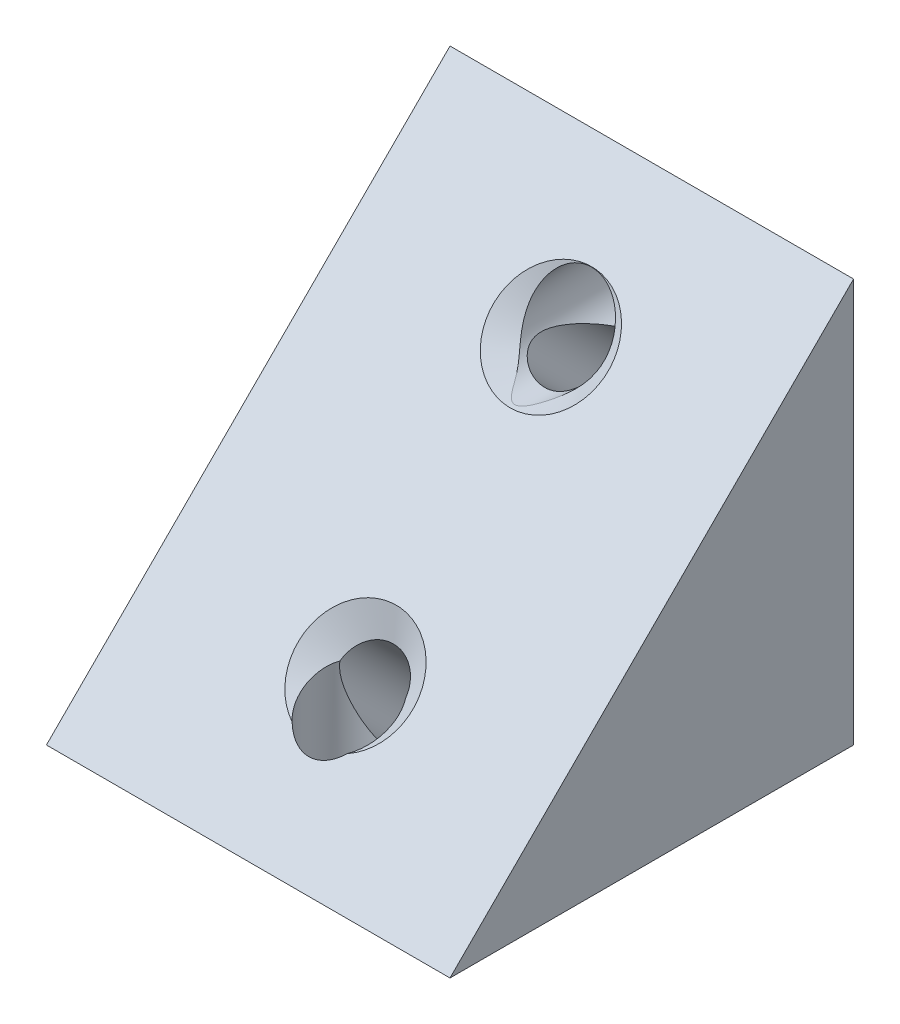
SolidWorks part; units mm, degrees
ref_plane "Спереди" through (0, 0, 0) normal (0, 0, 1) x (1, 0, 0)
ref_plane "Сверху" through (0, 0, 0) normal (0, 1, 0) x (1, 0, 0)
ref_plane "Справа" through (0, 0, 0) normal (1, 0, 0) x (0, 0, -1)
sketch "Эскиз1" plane through (0, 0, 0) normal (0, 0, 1) x (1, 0, 0)
  line L1 (-33.7187, 20) -> (-13.7187, 20)
  line L2 (-33.7187, 20) -> (-33.7187, 0)
  line L3 (-33.7187, 0) -> (-13.7187, 0)
  line L4 (-13.7187, 20) -> (-13.7187, 0)
extrude "Бобышка-Вытянуть1" add sketch "Эскиз1" along normal blind 20
chamfer "Фаска3" distance 20 angle 45 1 edges at (-23.7187, 20, 20)
sketch "Эскиз2" plane through (0, 0, 0) normal (0, -1, 0) x (1, 0, 0)
  line L0 (-13.7187, 20) -> (-13.7187, 10) construction
  line L1 (-13.7187, 20) -> (-13.7187, 0) construction
  circle A0 centre (-23.7187, 15) radius 2
extrude "Вырез-Вытянуть1" cut sketch "Эскиз2" against normal blind 10
sketch "Эскиз3" plane through (0, 0, 0) normal (0, 0, -1) x (-1, 0, 0)
  circle A1 centre (23.7187, 15) radius 2
extrude "Вырез-Вытянуть2" cut sketch "Эскиз3" against normal blind 10
hole_wizard "Зенковка для  винта с плоской головкой #4(100)2" positions "Эскиз7" profile "Эскиз6" countersink size "#4" standard "Ansi Inch"
sketch "Эскиз7" plane through (0, 10, 10) normal (0, 0.7071, 0.7071) x (1, 0, 0)
  point P0 (-23.7187, 7.0711)
  point P2 (-23.7187, -6.625)
sketch "Эскиз6" plane through (-23.7187, 15, 5) normal (1, 0, 0) x (0, -0.7071, 0.7071)
  line L0 (0, 0) -> (0, 14.1421)
  line L1 (0, 14.1421) -> (1.6319, 14.1421)
  line L2 (1.6319, 14.1421) -> (1.6319, 1.0284)
  line L3 (1.6319, 1.0284) -> (2.8575, 0)
  line L5 (2.8575, 0) -> (0, 0)
  line L6 (-1.6319, 1.0284) -> (-2.8575, 0) construction
  line L11 (0, -6.35) -> (0, 107.95) construction
  dimension "Диаметр сквозного отверстия" = 3.2639
  dimension "Глубина сквозного отверстия" = 14.1421
  dimension "Диаметр передней зенковки" = 5.715
  dimension "Угол передней зенковки" = 100
